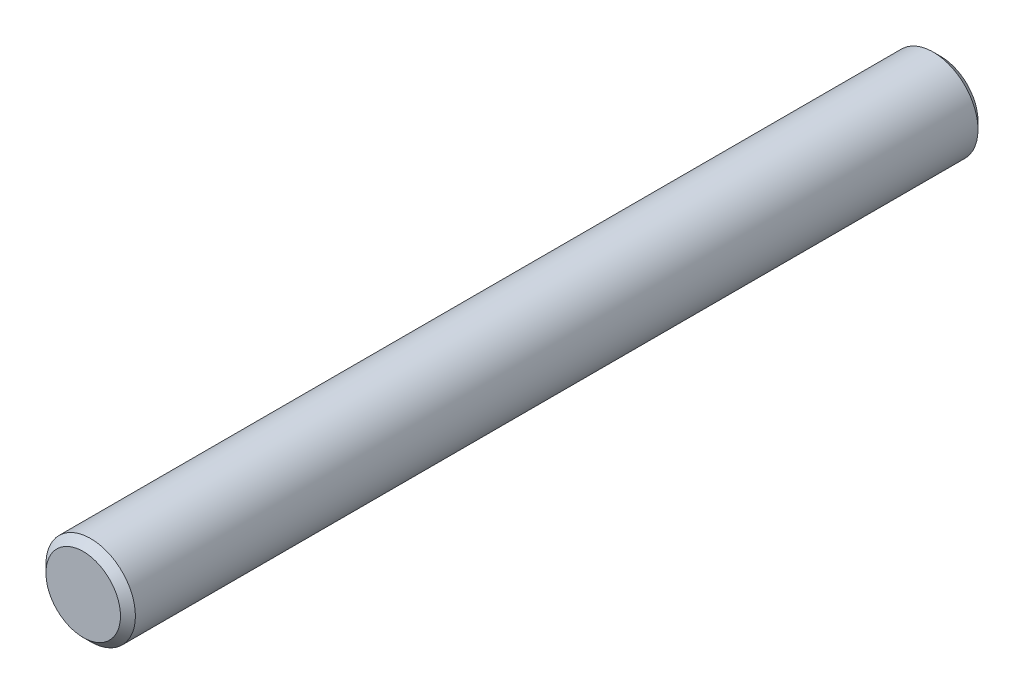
SolidWorks part; units mm, degrees
ref_plane "Plan de face" through (0, 0, 0) normal (0, 0, 1) x (1, 0, 0)
ref_plane "Plan de dessus" through (0, 0, 0) normal (0, 1, 0) x (1, 0, 0)
ref_plane "Plan de droite" through (0, 0, 0) normal (1, 0, 0) x (0, 0, -1)
sketch "Esquisse1" plane through (0, 0, 0) normal (0, 0, 1) x (1, 0, 0)
  circle A0 centre (0, 0) radius 6
  dimension "D1" = 12
extrude "Extrusion1" add sketch "Esquisse1" along normal blind 115
chamfer "Chanfrein1" distance 1 angle 45 2 edges at (6, 0, 0) (6, 0, 115)
